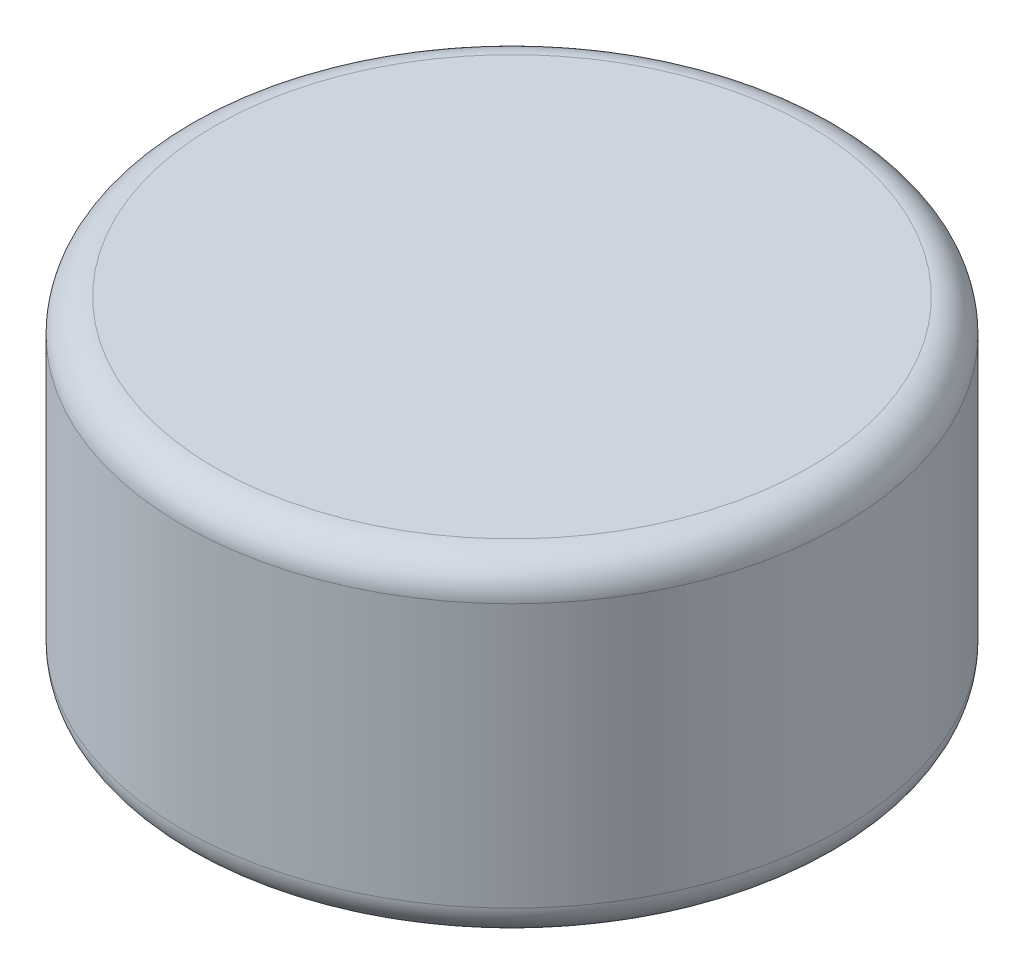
SolidWorks part; units mm, degrees
ref_plane "Front Plane" through (0, 0, 0) normal (0, 0, 1) x (1, 0, 0)
ref_plane "Top Plane" through (0, 0, 0) normal (0, 1, 0) x (1, 0, 0)
ref_plane "Right Plane" through (0, 0, 0) normal (1, 0, 0) x (0, 0, -1)
sketch "Sketch1" plane through (0, 0, 0) normal (0, 1, 0) x (1, 0, 0)
  circle A0 centre (0, 0) radius 1.5875
  dimension "OD" = 3.175
extrude "Boss-Extrude1" add sketch "Sketch1" along normal mid plane 1.5875
fillet "Fillet1" radius 0.1588 2 edges at (0, -0.7937, 1.5875) (0, 0.7937, 1.5875)
equation "\"D1@Fillet1\"=\"Thickness@Boss-Extrude1\"/10"
